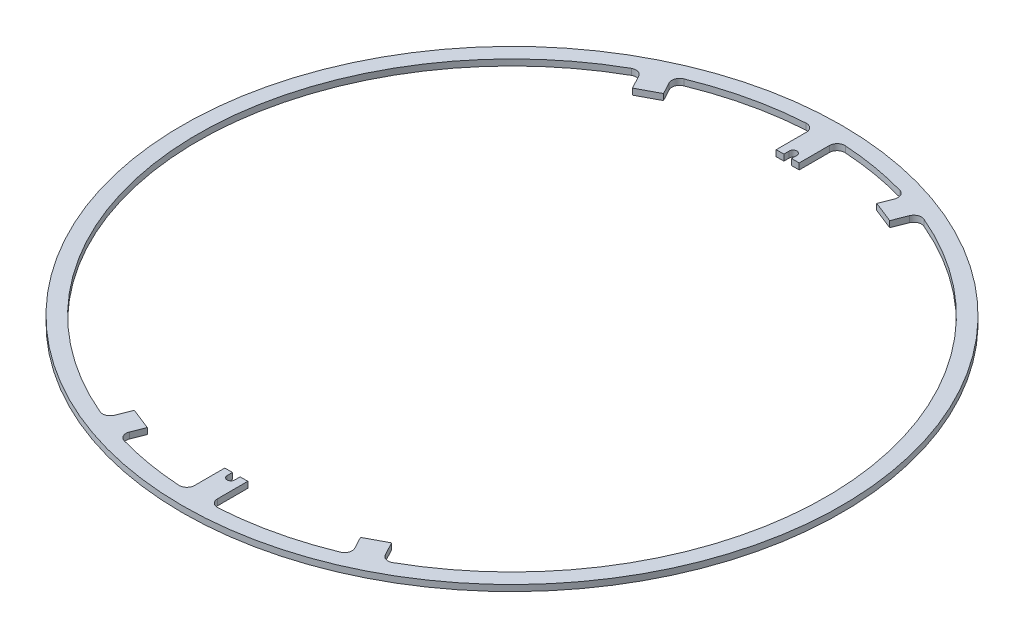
SolidWorks part; units mm, degrees
ref_plane "前视基准面" through (0, 0, 0) normal (0, 0, 1) x (1, 0, 0)
ref_plane "上视基准面" through (0, 0, 0) normal (0, 1, 0) x (1, 0, 0)
ref_plane "右视基准面" through (0, 0, 0) normal (1, 0, 0) x (0, 0, -1)
sketch "草图1" plane through (0, 0, 0) normal (0, 1, 0) x (1, 0, 0)
  circle A0 centre (0, 0) radius 43
  circle A1 centre (0, 0) radius 41
  circle A2 centre (0, 0) radius 35 construction
  dimension "D1" = 86
  dimension "D2" = 2
  dimension "D3" = 70
extrude "凸台-拉伸1" add sketch "草图1" along normal blind 0.8
sketch "草图2" plane through (0, 0.8, 0) normal (0, 1, 0) x (1, 0, 0)
  line L0 (0, 0) -> (0, 47.3857) construction
  line L1 (-1.5, 40.9726) -> (-1.5, 35.9726)
  line L2 (-1.5, 35.9726) -> (1.5, 35.9726)
  line L3 (1.5, 40.9726) -> (1.5, 35.9726)
  line L4 (0, 0) -> (51.4644, 0) construction
  line L5 (1.5, -40.9726) -> (1.5, -35.9726)
  line L6 (-1.5, -40.9726) -> (-1.5, -35.9726)
  line L7 (-1.5, -35.9726) -> (1.5, -35.9726)
  circle A0 centre (0, 0) radius 41 construction
  circle A1 centre (0, 0) radius 41
  point P10 (0, 35.9726)
  dimension "D1" = 5
  dimension "D2" = 3
extrude "凸台-拉伸2" add sketch "草图2" against normal up to surface (0.8 mm away) contours L7 L6 L5 M8 | L3 L1 L2 M8
fillet "圆角1" radius 1 2 edges at (1.5, 0.4, -40.9726) (-1.5, 0.4, -40.9726)
fillet "圆角2" radius 1 2 edges at (1.5, 0.4, 40.9726) (-1.5, 0.4, 40.9726)
sketch "草图3" plane through (0, 0, 0) normal (0, -1, 0) x (1, 0, 0)
  line L0 (0, 36.6726) -> (0, 35.9726) construction
  line L1 (1.5, 35.9726) -> (-1.5, 35.9726) construction
  line L2 (-0.5, 36.6726) -> (-0.5, 33.6726)
  line L3 (-0.5, 33.6726) -> (0.5, 33.6726)
  line L4 (0.5, 33.6726) -> (0.5, 36.6726)
  line L5 (0, 0) -> (11.294, 0) construction
  line L6 (0, -36.6726) -> (0, -35.9726) construction
  line L7 (0.5, -33.6726) -> (0.5, -36.6726)
  line L8 (-0.5, -33.6726) -> (0.5, -33.6726)
  line L9 (-0.5, -36.6726) -> (-0.5, -33.6726)
  arc A0 (0.5, 36.6726) -> (-0.5, 36.6726) centre (0, 36.6726) ccw
  arc A1 (0.5, -36.6726) -> (-0.5, -36.6726) centre (0, -36.6726) cw
  dimension "D1" = 1
  dimension "D2" = 3
  dimension "D3" = 0.7
extrude "切除-拉伸1" cut sketch "草图3" against normal through all
sketch "草图4" plane through (0, 0.8, 0) normal (0, 1, 0) x (1, 0, 0)
  line L0 (0, 0) -> (-15.0266, -38.1471) construction
  line L1 (0, 0) -> (0, -48.4381) construction
  line L2 (-15.0266, -38.1471) -> (-13.927, -35.3559)
  line L3 (-13.927, -35.3559) -> (-11.1358, -36.4554)
  line L4 (-11.1358, -36.4554) -> (-12.195, -39.1444)
  line L5 (15.0266, 38.1471) -> (13.927, 35.3559)
  line L6 (13.927, 35.3559) -> (11.1358, 36.4554)
  line L7 (11.1358, 36.4554) -> (12.195, 39.1444)
  arc A0 (-2.5625, 40.9198) -> (-2.5625, -40.9198) centre (0, 0) ccw construction
  arc A1 (-15.0266, -38.1471) -> (-12.195, -39.1444) centre (0, 0) ccw
  arc A2 (15.0266, 38.1471) -> (12.195, 39.1444) centre (0, 0) ccw
  point P16 (0, 0)
  dimension "D1" = 3
  dimension "D2" = 3
  dimension "D4" = 21.5
  dimension "D3" = 2
extrude "凸台-拉伸3" add sketch "草图4" against normal up to surface (0.8 mm away)
fillet "圆角3" radius 1 4 edges at (15.0266, 0.4, -38.1471) (12.195, 0.4, -39.1444) (-12.195, 0.4, 39.1444) (-15.0266, 0.4, 38.1471)
sketch "草图5" plane through (0, 0, 0) normal (0, -1, 0) x (1, 0, 0)
  line L0 (0, 0) -> (-13.927, 35.3559) construction
  line L1 (0, 0) -> (21.6481, 40.7141) construction
  line L2 (19.2483, 36.2009) -> (17.8399, 33.552)
  line L3 (17.8399, 33.552) -> (15.1911, 34.9604)
  line L4 (15.1911, 34.9604) -> (16.5479, 37.5122)
  line L5 (-15.1911, -34.9604) -> (-16.5479, -37.5122)
  line L6 (-17.8399, -33.552) -> (-15.1911, -34.9604)
  line L7 (-19.2483, -36.2009) -> (-17.8399, -33.552)
  arc A0 (15.9755, -37.7595) -> (2.5625, 40.9198) centre (0, 0) ccw construction
  arc A1 (19.2483, 36.2009) -> (16.5479, 37.5122) centre (0, 0) ccw
  arc A2 (-19.2483, -36.2009) -> (-16.5479, -37.5122) centre (0, 0) ccw
  point P18 (0, 0)
  dimension "D1" = 3
  dimension "D2" = 3
  dimension "D4" = 49.5
  dimension "D3" = 2
extrude "凸台-拉伸4" add sketch "草图5" against normal up to surface (0.8 mm away)
fillet "圆角4" radius 1 4 edges at (-16.5479, 0.4, -37.5122) (-19.2483, 0.4, -36.2009) (16.5479, 0.4, 37.5122) (19.2483, 0.4, 36.2009)
